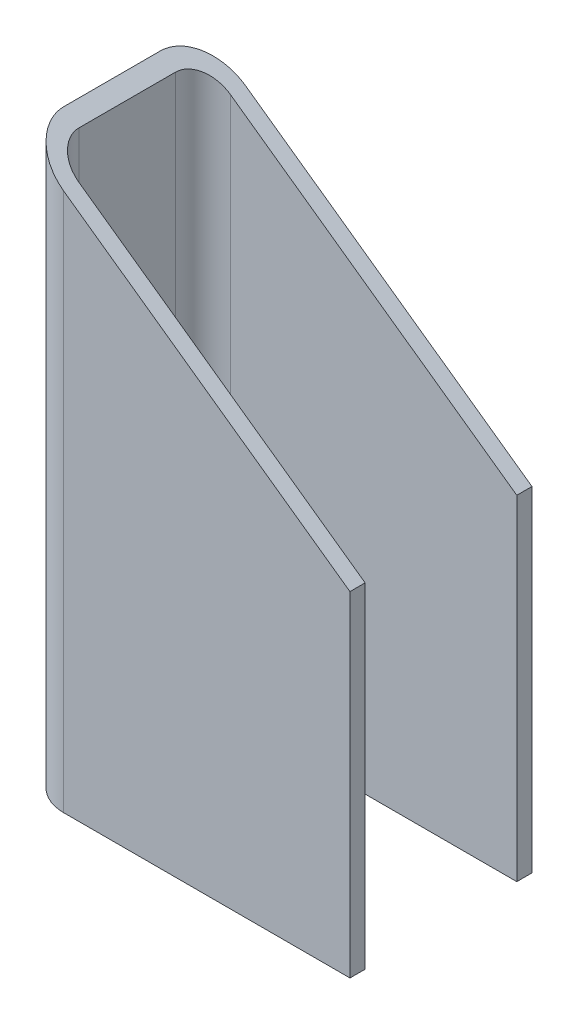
SolidWorks part; units mm, degrees
ref_plane "Alzado" through (0, 0, 0) normal (0, 0, 1) x (1, 0, 0)
ref_plane "Planta" through (0, 0, 0) normal (0, 1, 0) x (1, 0, 0)
ref_plane "Vista lateral" through (0, 0, 0) normal (1, 0, 0) x (0, 0, -1)
sketch "Croquis2" plane through (0, 0, 0) normal (0, 1, 0) x (1, 0, 0)
  line L0 (0, 222.285) -> (0, -222.285) construction
  line L21 (-75.5, 40) -> (75.5, 40)
  line L40 (-75.5, 48) -> (75.5, 48)
  line L42 (-98, 25.5) -> (-98, -25.5)
  line L43 (-90, 25.5) -> (-90, -25.5)
  line L46 (-98, 25.5) -> (-98, -25.5)
  line L47 (-90, 25.5) -> (-90, -25.5)
  line L50 (-98, 25.5) -> (-98, -25.5)
  line L51 (-90, 25.5) -> (-90, -25.5)
  line L54 (-98, 25.5) -> (-98, -25.5)
  line L55 (-90, 25.5) -> (-90, -25.5)
  line L56 (-75.5, -48) -> (75.5, -48)
  line L57 (-75.5, -40) -> (75.5, -40)
  line L58 (75.5, -48) -> (75.5, -40)
  line L59 (75.5, 0) -> (-343.7936, 0) construction
  line L60 (75.5, 40) -> (75.5, 48)
  arc A51 (-90, 25.5) -> (-75.5, 40) centre (-75.5, 25.5) cw
  arc A52 (-98, 25.5) -> (-75.5, 48) centre (-75.5, 25.5) cw
  arc A55 (-90, 25.5) -> (-75.5, 40) centre (-75.5, 25.5) cw
  arc A56 (-98, 25.5) -> (-75.5, 48) centre (-75.5, 25.5) cw
  arc A59 (-90, 25.5) -> (-75.5, 40) centre (-75.5, 25.5) cw
  arc A60 (-98, 25.5) -> (-75.5, 48) centre (-75.5, 25.5) cw
  arc A63 (-90, 25.5) -> (-75.5, 40) centre (-75.5, 25.5) cw
  arc A64 (-98, 25.5) -> (-75.5, 48) centre (-75.5, 25.5) cw
  arc A65 (-98, -25.5) -> (-75.5, -48) centre (-75.5, -25.5) ccw
  arc A66 (-90, -25.5) -> (-75.5, -40) centre (-75.5, -25.5) ccw
  arc A69 (-98, -25.5) -> (-75.5, -48) centre (-75.5, -25.5) ccw
  arc A70 (-90, -25.5) -> (-75.5, -40) centre (-75.5, -25.5) ccw
  arc A73 (-98, -25.5) -> (-75.5, -48) centre (-75.5, -25.5) ccw
  arc A74 (-90, -25.5) -> (-75.5, -40) centre (-75.5, -25.5) ccw
  arc A77 (-98, -25.5) -> (-75.5, -48) centre (-75.5, -25.5) ccw
  arc A78 (-90, -25.5) -> (-75.5, -40) centre (-75.5, -25.5) ccw
  point P4 (0, 0)
  point P7 (0, 0)
  point P9 (0, -40)
  point P10 (-98, 0)
  point P23 (0, 48)
  point P24 (0, 40)
  point P34 (-90, 0)
  point P35 (0, -48)
  dimension "D3" = 8
  dimension "D4" = 22.5
extrude "Saliente-Extruir1" add sketch "Croquis2" along normal blind 300
sketch "Croquis3" plane through (0, 0, 48) normal (0, 0, 1) x (1, 0, 0)
  line L1 (-98, 300) -> (75.5, 300) construction
  line L3 (-98, 300) -> (75.5, 176.517) construction
  line L6 (-98, 300) -> (75.5, 176.517)
  line L8 (75.5, 300) -> (-98, 300)
  line L9 (75.5, 176.517) -> (75.5, 300)
  line L10 (75.5, 300) -> (75.5, 0) construction
extrude "Cortar-Extruir1" cut sketch "Croquis3" against normal blind 300
